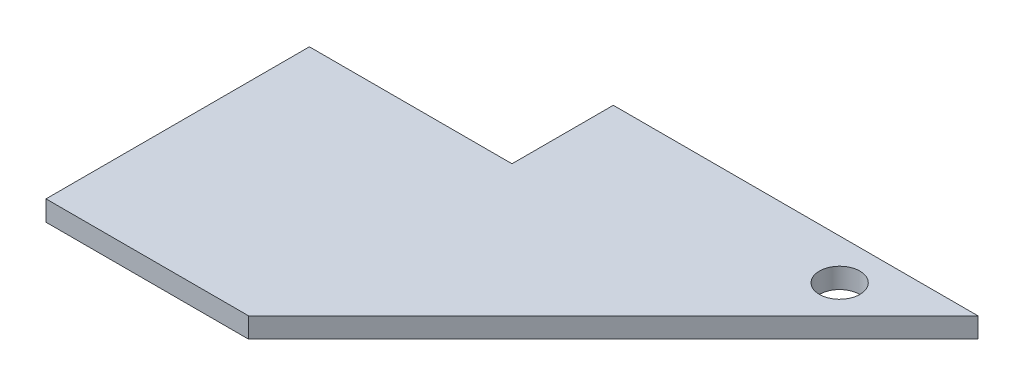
SolidWorks part; units mm, degrees
ref_plane "Front Plane" through (0, 0, 0) normal (0, 0, 1) x (1, 0, 0)
ref_plane "Top Plane" through (0, 0, 0) normal (0, 1, 0) x (1, 0, 0)
ref_plane "Right Plane" through (0, 0, 0) normal (1, 0, 0) x (0, 0, -1)
sketch "Sketch1" plane through (0, 0, 0) normal (0, 1, 0) x (1, 0, 0)
  line L0 (0, 0) -> (50, 0)
  line L1 (50, 0) -> (140, 90)
  line L2 (140, 90) -> (50, 90)
  line L3 (50, 90) -> (50, 65)
  line L4 (50, 65) -> (0, 65)
  line L5 (0, 65) -> (0, 0)
  dimension "D1" = 50
  dimension "D2" = 65
  dimension "D3" = 50
  dimension "D4" = 45
  dimension "D5" = 90
extrude "Extrude1" add sketch "Sketch1" along normal blind 5
sketch "Sketch2" plane through (0, 5, 0) normal (0, 1, 0) x (-1, 0, 0)
  line L1 (-50, 0) -> (-140, -90) construction
  line L2 (-140, -90) -> (-50, -90) construction
  circle A0 centre (-115.8579, -80) radius 5
  dimension "D1" = 10
  dimension "D2" = 10
  dimension "D3" = 10
extrude "Cut-Extrude1" cut sketch "Sketch2" against normal through all
